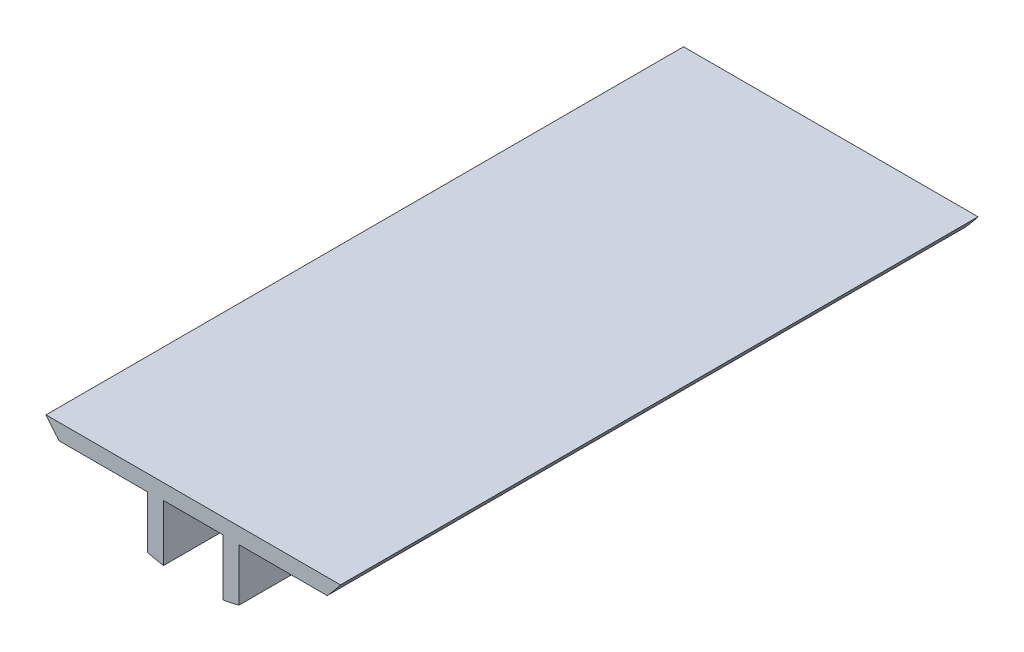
SolidWorks part; units mm, degrees
ref_plane "Front Plane" through (0, 0, 0) normal (0, 0, 1) x (1, 0, 0)
ref_plane "Top Plane" through (0, 0, 0) normal (0, 1, 0) x (1, 0, 0)
ref_plane "Right Plane" through (0, 0, 0) normal (1, 0, 0) x (0, 0, -1)
sketch "Sketch1" plane through (0, 0, 0) normal (0, 0, 1) x (1, 0, 0)
  line L0 (0, -1025) -> (0, -1723.5) construction
  line L1 (-250, 1025) -> (250, 1025) construction
  line L2 (-500, 775) -> (-500, -775) construction
  line L3 (-250, -1025) -> (250, -1025) construction
  line L4 (500, 775) -> (500, -775) construction
  line L5 (-500, 1025) -> (500, -1025) construction
  line L6 (-500, -1025) -> (500, 1025) construction
  line L7 (1385.5783, -1025) -> (-1385.5783, -1025)
  line L8 (-1260.8835, -1175) -> (-429.8053, -1175)
  line L9 (-429.8053, -1175) -> (-429.8053, -1669.0475)
  line L10 (-279.8053, -1700.6355) -> (-279.8053, -1169.7914)
  line L11 (-279.8053, -1169.7914) -> (279.8053, -1169.7914)
  line L13 (279.8053, -1700.6355) -> (279.8053, -1169.7914)
  line L14 (429.8053, -1175) -> (429.8053, -1669.0475)
  line L15 (1260.8835, -1175) -> (429.8053, -1175)
  circle A0 centre (0, 0) radius 1723.5 construction
  arc A1 (-500, -775) -> (-250, -1025) centre (-250, -775) ccw construction
  arc A2 (250, -1025) -> (500, -775) centre (250, -775) ccw construction
  arc A3 (250, 1025) -> (500, 775) centre (250, 775) cw construction
  arc A4 (-250, 1025) -> (-500, 775) centre (-250, 775) ccw construction
  arc A5 (-1385.5783, -1025) -> (-1260.8835, -1175) centre (0, 0) ccw
  arc A6 (-429.8053, -1669.0475) -> (-279.8053, -1700.6355) centre (0, 0) ccw
  arc A7 (429.8053, -1669.0475) -> (279.8053, -1700.6355) centre (0, 0) cw
  arc A8 (1385.5783, -1025) -> (1260.8835, -1175) centre (0, 0) cw
  point P31 (0, -1169.7914)
  dimension "D1" = 3447
  dimension "D2" = 250
  dimension "D3" = 2050
  dimension "D4" = 1000
  dimension "D5" = 494.0475
  dimension "D6" = 530.8442
  dimension "D7" = 150
  dimension "D8" = 150
extrude "Boss-Extrude1" add sketch "Sketch1" against normal blind 6000
